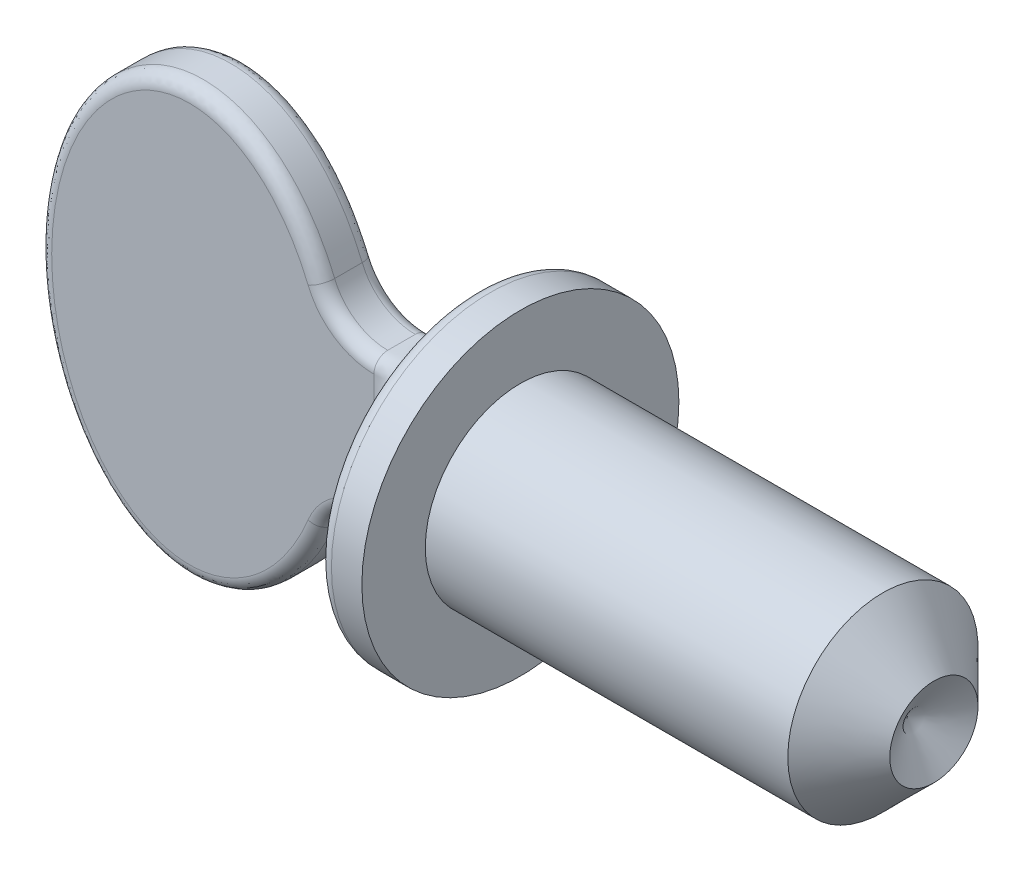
SolidWorks part; units mm, degrees
ref_plane "Front Plane" through (0, 0, 0) normal (0, 0, 1) x (1, 0, 0)
ref_plane "Top Plane" through (0, 0, 0) normal (0, 1, 0) x (1, 0, 0)
ref_plane "Right Plane" through (0, 0, 0) normal (1, 0, 0) x (0, 0, -1)
other "Configuration Table"
sketch "layout" plane through (0, 0, 0) normal (0, 0, 1) x (1, 0, 0)
  line L0 (0, 0) -> (13.208, 0) construction
  line L1 (5.588, 2.921) -> (5.588, -2.921)
  line L2 (3.3976, 1.3123) -> (4.8921, 1.3123) construction
  line L3 (5.588, 2.921) -> (4.7897, 2.921)
  line L4 (4.7897, 2.921) -> (4.7897, 3.2655) construction
  line L5 (4.2865, 1.706) -> (4.2865, 0)
  line L6 (4.2865, 1.706) -> (3.3355, 0.7551) construction
  line L7 (13.208, 1.7526) -> (13.208, 0)
  line L8 (3.3976, 1.3123) -> (3.3976, -1.3123)
  line L9 (13.208, 1.7526) -> (5.588, 1.7526)
  arc A0 (3.3976, 1.3123) -> (2.4197, 1.9685) centre (3.3976, 2.3692) cw
  arc A1 (4.7897, 2.921) -> (4.2865, 1.706) centre (3.0715, 2.921) cw
  arc A2 (3.3976, -1.3123) -> (2.4197, -1.9685) centre (3.3976, -2.3692) ccw
  ellipse E0 centre (0, 0) end of major axis (0, 3.937) minor radius 2.794 (2.4197, 1.9685) -> (2.4197, -1.9685) ccw
sketch "Sketch3" plane through (0, 0, 0) normal (0, 0, 1) x (1, 0, 0)
  line L0 (3.3976, 1.3123) -> (3.3976, -1.3123) construction
  line L1 (3.3976, 1.3123) -> (3.3976, -1.3123)
  arc A0 (3.3976, -1.3123) -> (2.4197, -1.9685) centre (3.3976, -2.3692) ccw construction
  arc A1 (2.4197, 1.9685) -> (3.3976, 1.3123) centre (3.3976, 2.3692) ccw construction
  arc A2 (3.3976, -1.3123) -> (2.4197, -1.9685) centre (3.3976, -2.3692) ccw
  arc A3 (2.4197, 1.9685) -> (3.3976, 1.3123) centre (3.3976, 2.3692) ccw
  ellipse E0 centre (0, 0) end of major axis (0, 3.937) minor radius 2.794 (2.4197, 1.9685) -> (2.4197, -1.9685) ccw construction
  ellipse E1 centre (0, 0) end of major axis (0, 3.937) minor radius 2.794 (2.4197, 1.9685) -> (2.4197, -1.9685) ccw
extrude "Extrude1" add sketch "Sketch3" along normal mid plane 1.016
fillet "Fillet1" radius 0.254 6 edges at (2.8088, 1.4916, -0.508) (2.8088, -1.4916, -0.508) (2.8088, 1.4916, 0.508) (2.8088, -1.4916, 0.508) (-2.794, 0, -0.508) (-2.794, 0, 0.508)
sketch "Sketch4" plane through (0, 0, 0) normal (0, 0, 1) x (1, 0, 0)
  line L0 (13.208, 1.7526) -> (13.208, 0) construction
  line L1 (13.208, 1.7526) -> (5.588, 1.7526) construction
  line L2 (5.588, 2.921) -> (5.588, -2.921) construction
  line L3 (5.588, 2.921) -> (4.7897, 2.921) construction
  line L4 (4.2865, 1.706) -> (4.2865, 0) construction
  line L5 (13.208, 0.8128) -> (13.208, 0) construction
  line L6 (12.2682, 1.7526) -> (5.588, 1.7526)
  line L7 (5.588, 2.921) -> (5.588, 1.7526)
  line L8 (5.588, 2.921) -> (4.7897, 2.921)
  line L9 (4.2865, 1.706) -> (4.2865, 0)
  line L10 (0, 0) -> (16.8942, 0) construction
  line L11 (12.7196, 0) -> (4.2865, 0)
  line L12 (12.2682, 1.7526) -> (13.208, 0.8128)
  line L13 (13.208, 0.8128) -> (12.7196, 0)
  line L14 (13.208, -0.8128) -> (12.7196, 0) construction
  line L15 (12.2682, -1.7526) -> (13.208, -0.8128) construction
  arc A0 (4.2865, 1.706) -> (4.7897, 2.921) centre (3.0715, 2.921) ccw construction
  arc A1 (4.2865, 1.706) -> (4.7897, 2.921) centre (3.0715, 2.921) ccw
revolve "Revolve1" add sketch "Sketch4" angle 360 about L10
loft "Loft1" add
fillet "Fillet2" radius 0.254 1 edges at (4.7897, 0, 2.921)
sketch "Sketch5" plane through (0, 0, 0) normal (0, 1, 0) x (1, 0, 0)
  line L0 (11.7227, 2.2981) -> (12.2682, 2.2981)
  line L1 (12.2682, 2.2981) -> (12.2682, 1.7526)
  line L2 (12.2682, 1.7526) -> (11.9954, 1.2802)
  line L3 (11.9954, 1.2802) -> (11.7227, 1.7526)
  line L4 (12.2682, -1.7526) -> (12.2682, 1.7526) construction
  line L5 (11.7227, 1.7526) -> (11.7227, 2.2981)
  line L7 (-3.6147, 0) -> (14.1406, 0) construction
  line L8 (12.2682, 1.7526) -> (5.588, 1.7526) construction
revolve "Cut-Revolve10" [suppressed] cut sketch "Sketch5" angle 360 about L7
pattern_linear "LPattern10" [suppressed] count 8 along (1, 0, 0)
equation "\"D4@layout\" = \"Head Height@layout\" / 3 * 2"
equation "\"D5@layout\" = \"Head Width@layout\" / 3"
equation "\"D6@layout\" = \"Head Width@layout\" / 2"
equation "\"D7@layout\" = \"D5@layout\" * 1.3"
equation "\"D8@layout\" = \"D4@layout\"  / 7"
equation "\"D1@Fillet1\" = \"Head Thickness@Extrude1\" / 4"
equation "\"D1@Fillet2\" = \"D1@Fillet1\""
equation "\"D1@Sketch5\" = ( \"Base Screw Dia@layout\"- \"Minor Dia@Cosmetic Thread1\" )  / 2"
equation "\"D1@LPattern10\" = int((\"Length@layout\"-\"O@Sketch4\"/2)/\"Advance@LPattern10\")"
